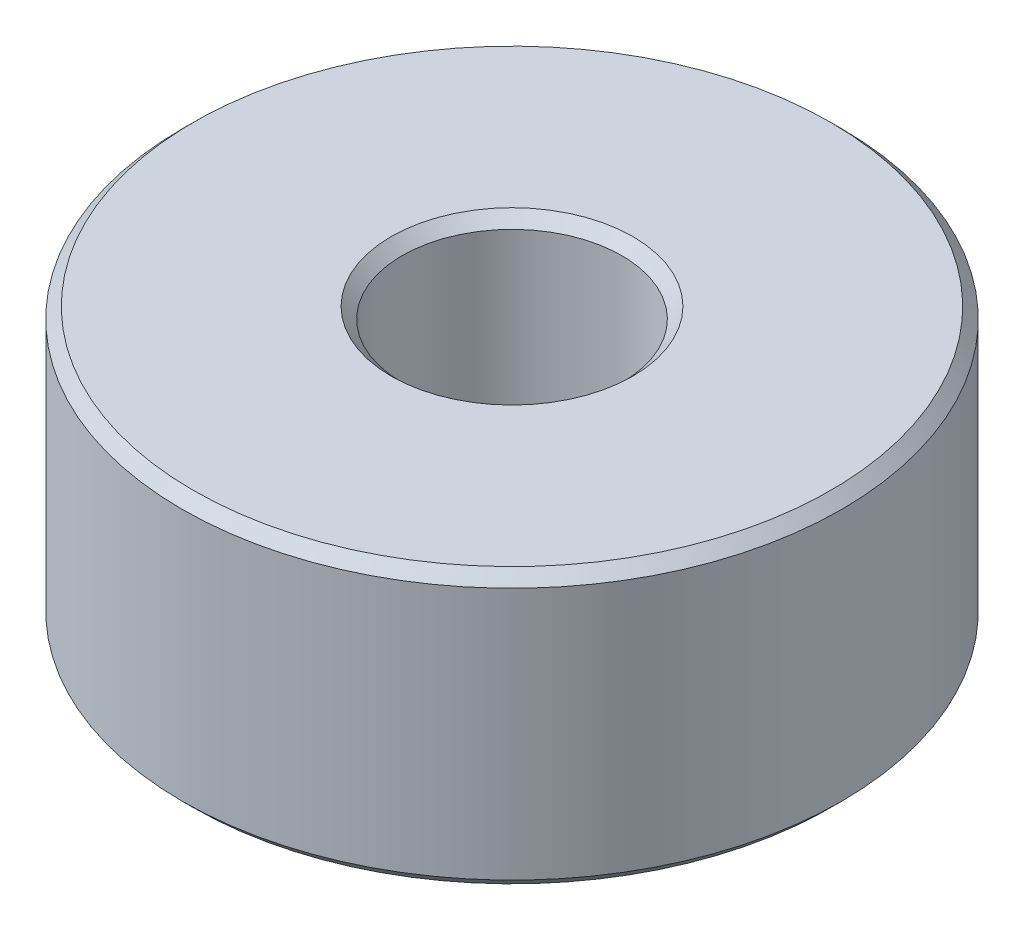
SolidWorks part; units mm, degrees
ref_plane "Front Plane" through (0, 0, 0) normal (0, 0, 1) x (1, 0, 0)
ref_plane "Top Plane" through (0, 0, 0) normal (0, 1, 0) x (1, 0, 0)
ref_plane "Right Plane" through (0, 0, 0) normal (1, 0, 0) x (0, 0, -1)
sketch "Sketch1" plane through (0, 0, 0) normal (0, 1, 0) x (1, 0, 0)
  circle A0 centre (0, 0) radius 3
  dimension "D1" = 6
extrude "Boss-Extrude1" add sketch "Sketch1" along normal blind 2.5
sketch "Sketch2" plane through (0, 2.5, 0) normal (0, 1, 0) x (1, 0, 0)
  circle A0 centre (0, 0) radius 1
  dimension "D1" = 2
extrude "Cut-Extrude1" cut sketch "Sketch2" against normal blind 5.5
chamfer "Chamfer1" distance 0.1 angle 45 3 edges at (0, 0, 3) (0, 2.5, 3) (0, 2.5, 1)
